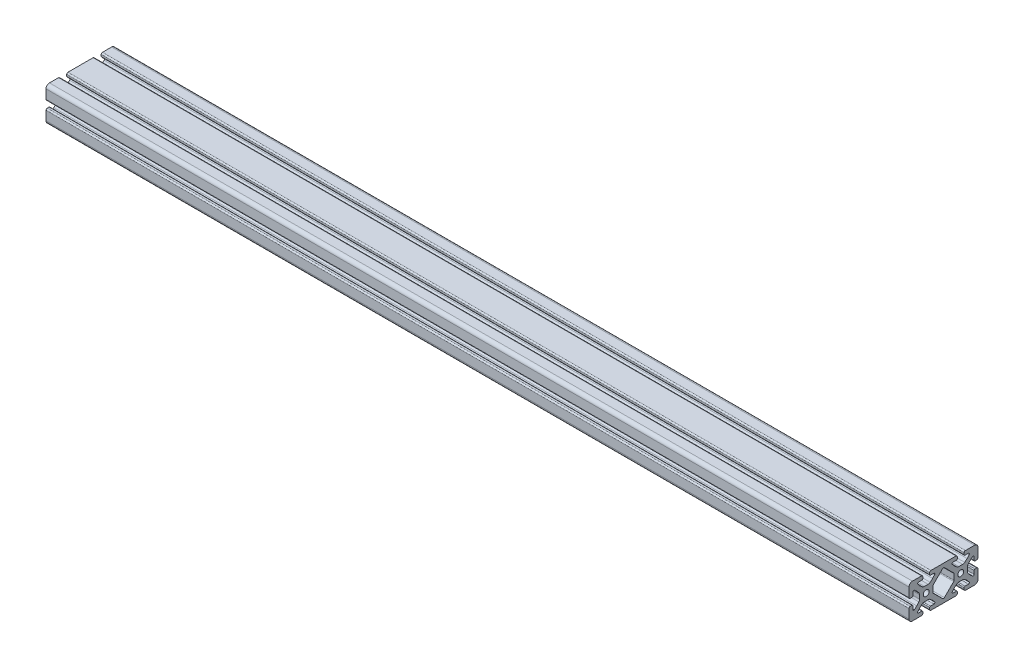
SolidWorks part; units mm, degrees
ref_plane "Ebene vorne" through (0, 0, 0) normal (0, 0, 1) x (1, 0, 0)
ref_plane "Ebene oben" through (0, 0, 0) normal (0, 1, 0) x (1, 0, 0)
ref_plane "Ebene rechts" through (0, 0, 0) normal (1, 0, 0) x (0, 0, -1)
sketch "Skizze1" plane through (0, 0, 0) normal (0, 1, 0) x (1, 0, 0)
  line L0 (0, 0) -> (1000, 0)
  dimension "D1" = 1000
other "Strukturbauteil1"
ref_plane "Ebene1" through (0, 0, 0) normal (1, 0, 0) x (0, 0, -1)
sketch "Model" plane through (0, 0, 0) normal (1, 0, 0) x (0, 0, -1)
  line L0 (-36, -20) -> (-25.5, -20)
  line L1 (-24, -18.5) -> (-24, -16.5)
  line L2 (-25, -15.5) -> (-28.9161, -15.5)
  line L3 (-22.1931, -7.75) -> (-17.8069, -7.75)
  line L4 (-11.0839, -15.5) -> (-15, -15.5)
  line L5 (-16, -16.5) -> (-16, -18.5)
  line L6 (-14.5, -20) -> (14.5, -20)
  line L7 (16, -18.5) -> (16, -16.5)
  line L8 (15, -15.5) -> (11.0839, -15.5)
  line L9 (17.8069, -7.75) -> (22.1931, -7.75)
  line L10 (28.9161, -15.5) -> (25, -15.5)
  line L11 (24, -16.5) -> (24, -18.5)
  line L12 (25.5, -20) -> (36, -20)
  line L13 (40, -16) -> (40, -5.5)
  line L14 (38.5, -4) -> (36.5, -4)
  line L15 (35.5, -5) -> (35.5, -8.9161)
  line L16 (27.75, -2.1931) -> (27.75, 2.1931)
  line L17 (35.5, 8.9161) -> (35.5, 5)
  line L18 (36.5, 4) -> (38.5, 4)
  line L19 (40, 5.5) -> (40, 16)
  line L20 (36, 20) -> (25.5, 20)
  line L21 (24, 18.5) -> (24, 16.5)
  line L22 (25, 15.5) -> (28.9161, 15.5)
  line L23 (22.1931, 7.75) -> (17.8069, 7.75)
  line L24 (11.0839, 15.5) -> (15, 15.5)
  line L25 (16, 16.5) -> (16, 18.5)
  line L26 (14.5, 20) -> (-14.5, 20)
  line L27 (-16, 18.5) -> (-16, 16.5)
  line L28 (-15, 15.5) -> (-11.0839, 15.5)
  line L29 (-17.8069, 7.75) -> (-22.1931, 7.75)
  line L30 (-28.9161, 15.5) -> (-25, 15.5)
  line L31 (-24, 16.5) -> (-24, 18.5)
  line L32 (-25.5, 20) -> (-36, 20)
  line L33 (-40, 16) -> (-40, 5.5)
  line L34 (-38.5, 4) -> (-36.5, 4)
  line L35 (-35.5, 5) -> (-35.5, 8.9161)
  line L36 (-27.75, 2.1931) -> (-27.75, -2.1931)
  line L37 (-35.5, -8.9161) -> (-35.5, -5)
  line L38 (-36.5, -4) -> (-38.5, -4)
  line L39 (-40, -5.5) -> (-40, -16)
  line L40 (-11.8107, -4.307) -> (-1.0607, -15.057)
  line L41 (1.0607, -15.057) -> (11.8107, -4.307)
  line L42 (12.25, -3.2463) -> (12.25, 3.2463)
  line L43 (11.8107, 4.307) -> (1.0607, 15.057)
  line L44 (-1.0607, 15.057) -> (-11.8107, 4.307)
  line L45 (-12.25, 3.2463) -> (-12.25, -3.2463)
  line L46 (-29.7888, 13.7733) -> (-27.3788, 10.9636)
  line L47 (-40, -20) -> (40, -20) construction
  line L48 (-40, -20) -> (-40, 20) construction
  line L49 (-40, 20) -> (40, 20) construction
  line L50 (40, -20) -> (40, 20) construction
  line L51 (-40, -20) -> (40, 20) construction
  line L52 (-40, 20) -> (40, -20) construction
  line L53 (-27.3788, 10.9636) -> (-24.5803, 8.5405)
  line L54 (-10.2112, 13.7733) -> (-12.6212, 10.9636)
  line L55 (-12.6212, 10.9636) -> (-15.4197, 8.5405)
  line L56 (10.2112, 13.7733) -> (12.6212, 10.9636)
  line L57 (12.6212, 10.9636) -> (15.4197, 8.5405)
  line L58 (24.5803, 8.5405) -> (27.3788, 10.9636)
  line L59 (27.3788, 10.9636) -> (29.7888, 13.7733)
  line L60 (33.7733, 9.7888) -> (30.9636, 7.3788)
  line L61 (30.9636, 7.3788) -> (28.5405, 4.5803)
  line L62 (28.5405, -4.5803) -> (30.9636, -7.3788)
  line L63 (30.9636, -7.3788) -> (33.7733, -9.7888)
  line L64 (29.7888, -13.7733) -> (27.3788, -10.9636)
  line L65 (27.3788, -10.9636) -> (24.5803, -8.5405)
  line L66 (15.4197, -8.5405) -> (12.6212, -10.9636)
  line L67 (12.6212, -10.9636) -> (10.2112, -13.7733)
  line L68 (-10.2112, -13.7733) -> (-12.6212, -10.9636)
  line L69 (-12.6212, -10.9636) -> (-15.4197, -8.5405)
  line L70 (-24.5803, -8.5405) -> (-27.3788, -10.9636)
  line L71 (-27.3788, -10.9636) -> (-29.7888, -13.7733)
  line L72 (-33.7733, -9.7888) -> (-30.9636, -7.3788)
  line L73 (-30.9636, -7.3788) -> (-28.5405, -4.5803)
  line L74 (-28.5405, 4.5803) -> (-30.9636, 7.3788)
  line L75 (-30.9636, 7.3788) -> (-33.7733, 9.7888)
  circle A0 centre (-20, 0) radius 3.4
  circle A1 centre (20, 0) radius 3.4
  arc A2 (-40, -16) -> (-36, -20) centre (-36, -16) ccw
  arc A3 (-25.5, -20) -> (-24, -18.5) centre (-25.5, -18.5) ccw
  arc A4 (-24, -16.5) -> (-25, -15.5) centre (-25, -16.5) ccw
  arc A5 (-29.7888, -13.7733) -> (-28.9161, -15.5) centre (-28.9161, -14.4161) ccw
  arc A7 (-22.1931, -7.75) -> (-24.5803, -8.5405) centre (-22.1931, -11.75) ccw
  arc A8 (-15.4197, -8.5405) -> (-17.8069, -7.75) centre (-17.8069, -11.75) ccw
  arc A10 (-11.0839, -15.5) -> (-10.2112, -13.7733) centre (-11.0839, -14.4161) ccw
  arc A11 (-15, -15.5) -> (-16, -16.5) centre (-15, -16.5) ccw
  arc A12 (-16, -18.5) -> (-14.5, -20) centre (-14.5, -18.5) ccw
  arc A13 (14.5, -20) -> (16, -18.5) centre (14.5, -18.5) ccw
  arc A14 (16, -16.5) -> (15, -15.5) centre (15, -16.5) ccw
  arc A15 (10.2112, -13.7733) -> (11.0839, -15.5) centre (11.0839, -14.4161) ccw
  arc A17 (17.8069, -7.75) -> (15.4197, -8.5405) centre (17.8069, -11.75) ccw
  arc A18 (24.5803, -8.5405) -> (22.1931, -7.75) centre (22.1931, -11.75) ccw
  arc A20 (28.9161, -15.5) -> (29.7888, -13.7733) centre (28.9161, -14.4161) ccw
  arc A21 (25, -15.5) -> (24, -16.5) centre (25, -16.5) ccw
  arc A22 (24, -18.5) -> (25.5, -20) centre (25.5, -18.5) ccw
  arc A23 (36, -20) -> (40, -16) centre (36, -16) ccw
  arc A24 (40, -5.5) -> (38.5, -4) centre (38.5, -5.5) ccw
  arc A25 (36.5, -4) -> (35.5, -5) centre (36.5, -5) ccw
  arc A26 (33.7733, -9.7888) -> (35.5, -8.9161) centre (34.4161, -8.9161) ccw
  arc A28 (27.75, -2.1931) -> (28.5405, -4.5803) centre (31.75, -2.1931) ccw
  arc A29 (28.5405, 4.5803) -> (27.75, 2.1931) centre (31.75, 2.1931) ccw
  arc A31 (35.5, 8.9161) -> (33.7733, 9.7888) centre (34.4161, 8.9161) ccw
  arc A32 (35.5, 5) -> (36.5, 4) centre (36.5, 5) ccw
  arc A33 (38.5, 4) -> (40, 5.5) centre (38.5, 5.5) ccw
  arc A34 (40, 16) -> (36, 20) centre (36, 16) ccw
  arc A35 (25.5, 20) -> (24, 18.5) centre (25.5, 18.5) ccw
  arc A36 (24, 16.5) -> (25, 15.5) centre (25, 16.5) ccw
  arc A37 (29.7888, 13.7733) -> (28.9161, 15.5) centre (28.9161, 14.4161) ccw
  arc A39 (22.1931, 7.75) -> (24.5803, 8.5405) centre (22.1931, 11.75) ccw
  arc A40 (15.4197, 8.5405) -> (17.8069, 7.75) centre (17.8069, 11.75) ccw
  arc A42 (11.0839, 15.5) -> (10.2112, 13.7733) centre (11.0839, 14.4161) ccw
  arc A43 (15, 15.5) -> (16, 16.5) centre (15, 16.5) ccw
  arc A44 (16, 18.5) -> (14.5, 20) centre (14.5, 18.5) ccw
  arc A45 (-14.5, 20) -> (-16, 18.5) centre (-14.5, 18.5) ccw
  arc A46 (-16, 16.5) -> (-15, 15.5) centre (-15, 16.5) ccw
  arc A47 (-10.2112, 13.7733) -> (-11.0839, 15.5) centre (-11.0839, 14.4161) ccw
  arc A49 (-17.8069, 7.75) -> (-15.4197, 8.5405) centre (-17.8069, 11.75) ccw
  arc A50 (-24.5803, 8.5405) -> (-22.1931, 7.75) centre (-22.1931, 11.75) ccw
  arc A52 (-28.9161, 15.5) -> (-29.7888, 13.7733) centre (-28.9161, 14.4161) ccw
  arc A53 (-25, 15.5) -> (-24, 16.5) centre (-25, 16.5) ccw
  arc A54 (-24, 18.5) -> (-25.5, 20) centre (-25.5, 18.5) ccw
  arc A55 (-36, 20) -> (-40, 16) centre (-36, 16) ccw
  arc A56 (-40, 5.5) -> (-38.5, 4) centre (-38.5, 5.5) ccw
  arc A57 (-36.5, 4) -> (-35.5, 5) centre (-36.5, 5) ccw
  arc A58 (-33.7733, 9.7888) -> (-35.5, 8.9161) centre (-34.4161, 8.9161) ccw
  arc A60 (-27.75, 2.1931) -> (-28.5405, 4.5803) centre (-31.75, 2.1931) ccw
  arc A61 (-28.5405, -4.5803) -> (-27.75, -2.1931) centre (-31.75, -2.1931) ccw
  arc A63 (-35.5, -8.9161) -> (-33.7733, -9.7888) centre (-34.4161, -8.9161) ccw
  arc A64 (-35.5, -5) -> (-36.5, -4) centre (-36.5, -5) ccw
  arc A65 (-38.5, -4) -> (-40, -5.5) centre (-38.5, -5.5) ccw
  arc A66 (-12.25, -3.2463) -> (-11.8107, -4.307) centre (-10.75, -3.2463) ccw
  arc A67 (-1.0607, -15.057) -> (1.0607, -15.057) centre (0, -13.9963) ccw
  arc A68 (11.8107, -4.307) -> (12.25, -3.2463) centre (10.75, -3.2463) ccw
  arc A69 (12.25, 3.2463) -> (11.8107, 4.307) centre (10.75, 3.2463) ccw
  arc A70 (1.0607, 15.057) -> (-1.0607, 15.057) centre (0, 13.9963) ccw
  arc A71 (-11.8107, 4.307) -> (-12.25, 3.2463) centre (-10.75, 3.2463) ccw
  point P16 (0, 0)
  point P190 (0, 0)
  point P196 (-40, 0)
  point P197 (-20, 20)
  point P198 (-20, -20)
  point P199 (0, -20)
  point P200 (0, 20)
  point P201 (20, 20)
  point P202 (40, 0)
  point P203 (20, -20)
